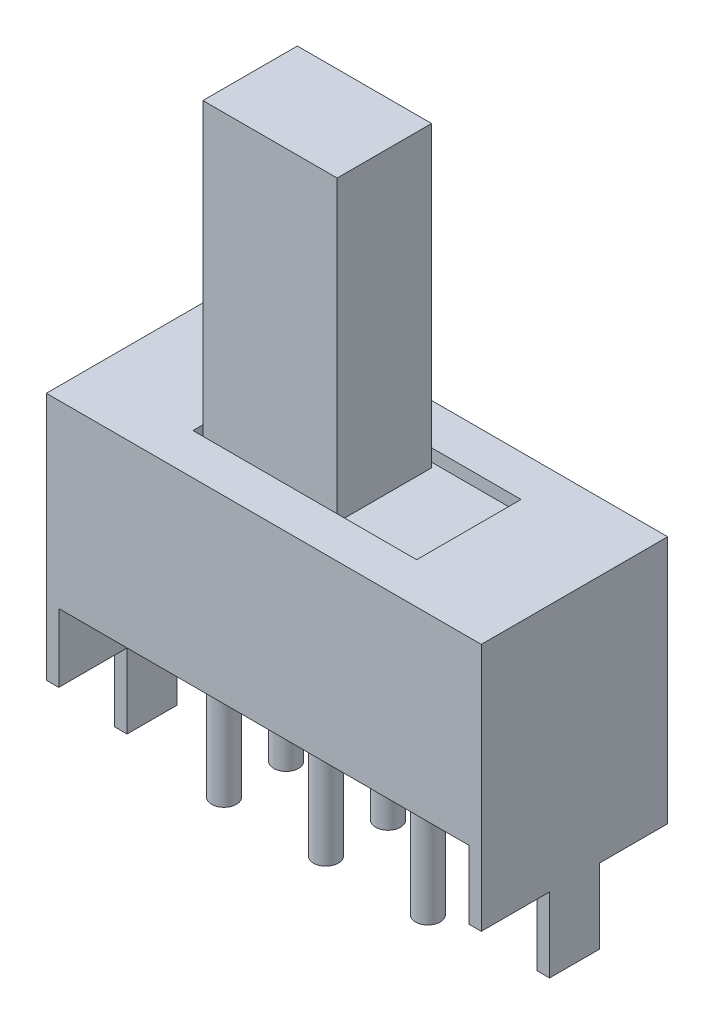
SolidWorks part; units mm, degrees
ref_plane "Plan de face" through (0, 0, 0) normal (0, 0, 1) x (1, 0, 0)
ref_plane "Plan de dessus" through (0, 0, 0) normal (0, 1, 0) x (1, 0, 0)
ref_plane "Plan de droite" through (0, 0, 0) normal (1, 0, 0) x (0, 0, -1)
sketch "Esquisse1" plane through (0, 0, 0) normal (0, 0, 1) x (1, 0, 0)
  line L0 (0, 17.8929) -> (0, -20.1758) construction
  line L1 (-28.9049, 0) -> (24.6989, 0) construction
  line L2 (-18.0567, 7.25) -> (19.2926, 7.25) construction
  line L3 (-8.25, 10.8359) -> (-8.25, -7.2022) construction
  line L4 (-4.1, 2.1102) -> (-4.1, -7.2022) construction
  line L5 (-12.3434, -5) -> (20.8179, -5) construction
  line L6 (8.25, 10.8359) -> (8.25, -7.2022) construction
  line L8 (-8.25, 7.25) -> (8.25, 7.25)
  line L9 (-8.25, 7.25) -> (-8.25, 0)
  line L10 (-8.25, 0) -> (8.25, 0)
  line L11 (8.25, 7.25) -> (8.25, 0)
  dimension "D1" = 8.25
  dimension "D2" = 7.25
  dimension "D3" = 5
  dimension "D4" = 4.1
  dimension "D5" = 8.25
extrude "Extrusion1" add sketch "Esquisse1" along normal blind 7.5
sketch "Esquisse2" plane through (8.25, 0, 0) normal (1, 0, 0) x (0, 0, -1)
  line L0 (2.0155, 7.25) -> (-9.9131, 7.25) construction
  line L1 (-7.5, 9.5395) -> (-7.5, -5.9998) construction
  line L2 (0, 8.5251) -> (0, -5.9998) construction
  line L3 (-8.9542, -2.75) -> (2.0155, -2.75) construction
  line L4 (-8.4864, -5.75) -> (2.0155, -5.75) construction
  line L5 (-4.75, -2.1994) -> (-4.75, -6.1869) construction
  line L6 (-3.75, 8.9319) -> (-3.75, -5.9998) construction
  line L7 (-2.75, -2.1994) -> (-2.75, -6.1869) construction
  line L8 (-2.75, -2.75) -> (-2.75, -5.75)
  line L9 (-2.75, -5.75) -> (-4.75, -5.75)
  line L10 (-4.75, -5.75) -> (-4.75, -2.75)
  line L11 (-4.75, -2.75) -> (-7.5, -2.75)
  line L12 (-7.5, -2.75) -> (-7.5, 7.25)
  line L13 (-7.5, 7.25) -> (0, 7.25)
  line L14 (0, 7.25) -> (0, -2.75)
  line L15 (0, -2.75) -> (-2.75, -2.75)
  dimension "D1" = 3.75
  dimension "D2" = 1
  dimension "D3" = 13
  dimension "D4" = 10
extrude "Extrusion2" add sketch "Esquisse2" along normal blind 0.5
ref_plane "Plan1" through (0, 0, 0) normal (1, 0, 0) x (0, 0, -1)
mirror "Symétrie1" about plane through (0, 0, 0) normal (1, 0, 0) of "Extrusion2"
sketch "Esquisse3" plane through (0, 7.25, 0) normal (0, 1, 0) x (-1, 0, 0)
  line L0 (10.5282, 0) -> (-10.4931, 0) construction
  line L1 (10.5282, 3.75) -> (-10.1951, 3.75) construction
  line L2 (6.4432, 1.65) -> (-6.3204, 1.65) construction
  line L3 (6.4432, 5.85) -> (-6.3204, 5.85) construction
  line L4 (-4.5, 1.1114) -> (-4.5, 6.6516) construction
  line L5 (4.5, 1.2341) -> (4.5, 6.3886) construction
  line L6 (0, -1.7639) -> (0, 8.9834) construction
  line L9 (4.5, 1.65) -> (-4.5, 1.65)
  line L10 (4.5, 1.65) -> (4.5, 5.85)
  line L11 (4.5, 5.85) -> (-4.5, 5.85)
  line L12 (-4.5, 1.65) -> (-4.5, 5.85)
  dimension "D1" = 3.75
  dimension "D2" = 2.1
  dimension "D3" = 4.5
  dimension "D4" = 9
  dimension "D5" = 4.2
extrude "Enlèv. mat.-Extru.1" cut sketch "Esquisse3" against normal blind 0.5
sketch "Esquisse4" plane through (0, 6.75, 0) normal (0, 1, 0) x (-1, 0, 0)
  line L0 (4.5, 6.3022) -> (4.5, 0.7094) construction
  line L1 (5.8821, 3.497) -> (-5.9522, 3.497) construction
  line L2 (6.4957, 1.65) -> (-7.0042, 1.65) construction
  line L3 (4.3, 1.0074) -> (4.3, 6.5477) construction
  line L4 (-1.1, 6.5477) -> (-1.1, 1.0074) construction
  line L5 (5.3211, 1.85) -> (-1.6393, 1.85) construction
  line L6 (4.9354, 5.65) -> (-2.1127, 5.65) construction
  line L8 (4.3, 1.85) -> (-1.1, 1.85)
  line L9 (4.3, 1.85) -> (4.3, 5.65)
  line L10 (4.3, 5.65) -> (-1.1, 5.65)
  line L11 (-1.1, 1.85) -> (-1.1, 5.65)
  dimension "D1" = 0.2
  dimension "D2" = 3.8
  dimension "D3" = 0.2
  dimension "D4" = 5.4
extrude "Extrusion3" add sketch "Esquisse4" along normal blind 12
sketch "Esquisse5" plane through (0, 0, 0) normal (0, -1, 0) x (1, 0, 0)
  line L0 (0, -1.4961) -> (0, 9.5773) construction
  line L1 (-12.9826, 3.75) -> (5.7661, 3.75) construction
  line L2 (-4.1, -1.4961) -> (-4.1, 9.5773) construction
  line L3 (4.1, 9.5773) -> (4.1, -1.4961) construction
  line L4 (-7.563, 2.5) -> (5.7661, 2.5) construction
  line L5 (10.5689, 0) -> (-12.9826, 0) construction
  circle A0 centre (-4.1, 2.5) radius 0.5
  circle A1 centre (0, 2.5) radius 0.5
  circle A2 centre (4.1, 2.5) radius 0.5
  circle A3 centre (-4.1, 5) radius 0.5
  circle A4 centre (0, 5) radius 0.5
  circle A5 centre (4.1, 5) radius 0.5
  dimension "D1" = 4.1
  dimension "D2" = 4.1
  dimension "D3" = 3.75
  dimension "D4" = 1.25
extrude "Extrusion4" add sketch "Esquisse5" along normal blind 5.75
